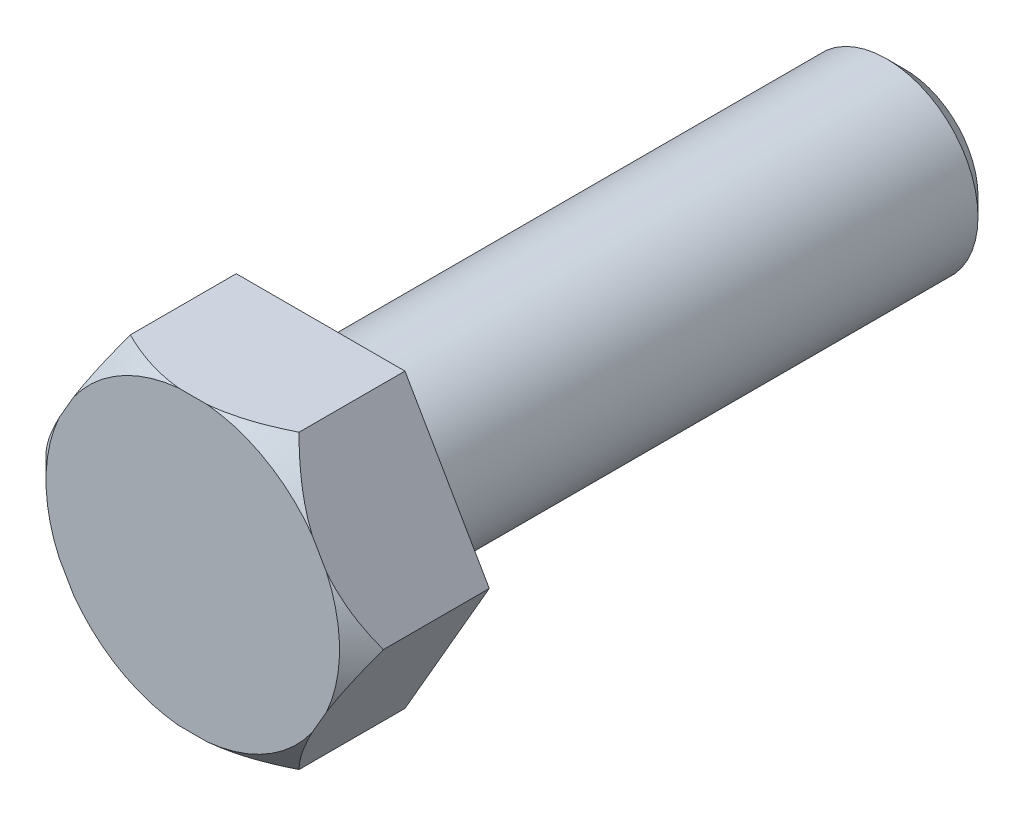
SolidWorks part; units mm, degrees
ref_plane "Plan de face" through (0, 0, 0) normal (0, 0, 1) x (1, 0, 0)
ref_plane "Plan de dessus" through (0, 0, 0) normal (0, 1, 0) x (1, 0, 0)
ref_plane "Plan de droite" through (0, 0, 0) normal (1, 0, 0) x (0, 0, -1)
sketch "Esquisse1" plane through (0, 0, 0) normal (0, 0, 1) x (1, 0, 0)
  line L1 (4.6188, 0) -> (2.3094, 4)
  line L2 (2.3094, 4) -> (-2.3094, 4)
  line L3 (-2.3094, 4) -> (-4.6188, 0)
  line L4 (-4.6188, 0) -> (-2.3094, -4)
  line L5 (-2.3094, -4) -> (2.3094, -4)
  line L6 (2.3094, -4) -> (4.6188, 0)
  circle A0 centre (0, 0) radius 4 construction
  dimension "D1" = 8
extrude "Boss.-Extru.1" add sketch "Esquisse1" along normal blind 3.5
sketch "Esquisse3" plane through (0, 0, 0) normal (0, 1, 0) x (1, 0, 0)
  line L0 (0, 2.9031) -> (0, -10.4428) construction
  line L1 (-4.6188, -2.9) -> (-4.0188, -3.5)
  line L2 (-9.0249, -6.5429) -> (-4.0188, -6.5429)
  line L3 (-9.0249, -6.5429) -> (-9.0249, -2.9)
  line L4 (-9.0249, -2.9) -> (-4.6188, -2.9)
  line L5 (-4.0188, -6.5429) -> (-4.0188, -3.5)
  line L6 (-4.6188, -3.5) -> (-4.6188, 0) construction
  line L8 (-2.3094, -3.5) -> (-4.6188, -3.5) construction
  dimension "D1" = 0.6
  dimension "D2" = 0.6
revolve "Enlèvement de matière-Révolution2" cut sketch "Esquisse3" angle 360 about L0
sketch "Esquisse4" plane through (0, 0, 0) normal (1, 0, 0) x (0, 0, -1)
  line L0 (0, 0) -> (83.8832, 0) construction
  line L1 (0, -2.5) -> (15.5, -2.5)
  line L2 (0, -4) -> (0, 0) construction
  line L3 (16, -2) -> (16, 0)
  line L4 (15.5, -2.5) -> (16, -2)
  line L5 (0, -2.5) -> (0, 0)
  line L6 (0, 0) -> (16, 0)
  point P4 (16, -2.5)
  dimension "D1" = 2.5
  dimension "D2" = 16
  dimension "D6" = 0.5
revolve "Révolution2" add sketch "Esquisse4" angle 360 about L0
